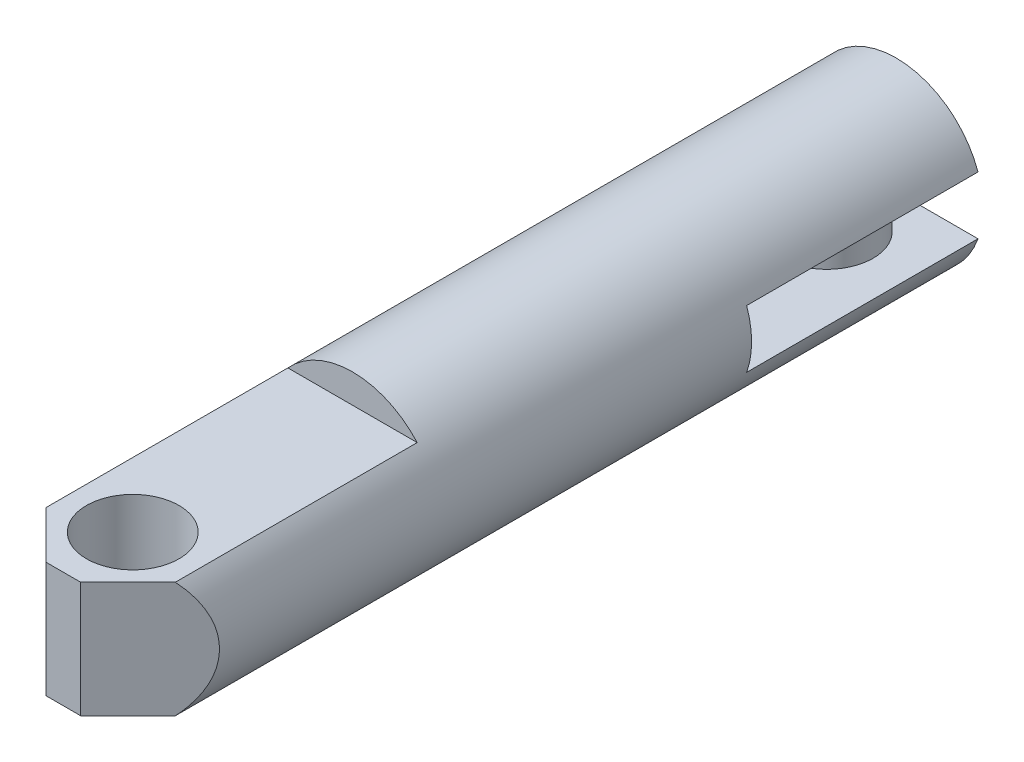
SolidWorks part; units mm, degrees
ref_plane "Plan 1" through (0, 0, 0) normal (0, 0, 1) x (1, 0, 0)
ref_plane "Plan 2" through (0, 0, 0) normal (0, 1, 0) x (1, 0, 0)
ref_plane "Plan 3" through (0, 0, 0) normal (1, 0, 0) x (0, 0, -1)
sketch "Esquisse2" plane through (0, 0, 0) normal (0, 0, 1) x (1, 0, 0)
  circle A0 centre (0, 0) radius 7.5
  dimension "D1" = 15
extrude "Base-Extrusion" add sketch "Esquisse2" along normal blind 72
sketch "Esquisse3" plane through (0, 0, 72) normal (0, 0, 1) x (1, 0, 0)
  line L0 (-9, 0) -> (10, 0) construction
  line L1 (-7.5, 7.5) -> (7.5, 7.5)
  line L2 (-7.5, 7.5) -> (-7.5, 5)
  line L3 (-7.5, 5) -> (7.5, 5)
  line L4 (7.5, 7.5) -> (7.5, 5)
  line L5 (7.5, -7.5) -> (7.5, -5)
  line L6 (-7.5, -5) -> (7.5, -5)
  line L7 (-7.5, -7.5) -> (-7.5, -5)
  line L8 (-7.5, -7.5) -> (7.5, -7.5)
  circle A0 centre (0, 0) radius 7.5 construction
  dimension "D1" = 10
extrude "Enlèv. mat.-Extru.2" cut sketch "Esquisse3" against normal blind 25
sketch "Esquisse4" plane through (0, 5, 0) normal (0, 1, 0) x (-1, 0, 0)
  line L0 (0, 72) -> (0, 47) construction
  line L1 (5.5902, 72) -> (-5.5902, 72) construction
  circle A0 centre (0, 66) radius 4
  dimension "D1" = 8
  dimension "D2" = 6
extrude "Enlèv. mat.-Extru.5" cut sketch "Esquisse4" against normal through all
sketch "Esquisse5" plane through (0, 0, 0) normal (0, 0, -1) x (-1, 0, 0)
  line L0 (-9, 0) -> (9, 0) construction
  line L2 (-7.5, 2.5) -> (7.5, 2.5)
  line L3 (-7.5, 2.5) -> (-7.5, -2.5)
  line L4 (-7.5, -2.5) -> (7.5, -2.5)
  line L5 (7.5, 2.5) -> (7.5, -2.5)
  circle A0 centre (0, 0) radius 7.5 construction
  dimension "D1" = 5
extrude "Enlèv. mat.-Extru.4" cut sketch "Esquisse5" against normal blind 20
sketch "Esquisse6" plane through (0, -2.5, 0) normal (0, 1, 0) x (-1, 0, 0)
  line L0 (0, 20) -> (0, 0) construction
  circle A0 centre (0, 66) radius 4 construction
  circle A1 centre (0, 6) radius 4
  dimension "D1" = 60
extrude "Boss.-Extru.1" add sketch "Esquisse6" along normal up to next
sketch "Esquisse7" plane through (0, 5, 0) normal (0, 1, 0) x (-1, 0, 0)
  line L0 (0, 73.8357) -> (0, 58.1372) construction
  line L1 (0, 20) -> (0, 0) construction
  line L2 (-1.5, 72) -> (-7.5, 66)
  line L3 (5.5902, 72) -> (-5.5902, 72) construction
  line L4 (-1.5, 72) -> (-7.5, 72)
  line L5 (-7.5, 72) -> (-7.5, 20) construction
  line L6 (-7.5, 72) -> (-7.5, 66)
  line L7 (1.5, 72) -> (7.5, 72)
  line L8 (1.5, 72) -> (7.5, 66)
  line L9 (7.5, 72) -> (7.5, 66)
  dimension "D1" = 6
  dimension "D2" = 6
extrude "Enlèv. mat.-Extru.6" cut sketch "Esquisse7" against normal through all
sketch "Esq_WRNL_Compact001" plane through (0, 0, 0) normal (0, 0, 1) x (1, 0, 0)
  line L0 (-8.5, -8.5) -> (-8.5, 8.5)
  line L1 (8.5, -8.5) -> (8.5, 8.5)
  line L2 (-8.5, -8.5) -> (8.5, -8.5)
  line L3 (-8.5, 8.5) -> (8.5, 8.5)
